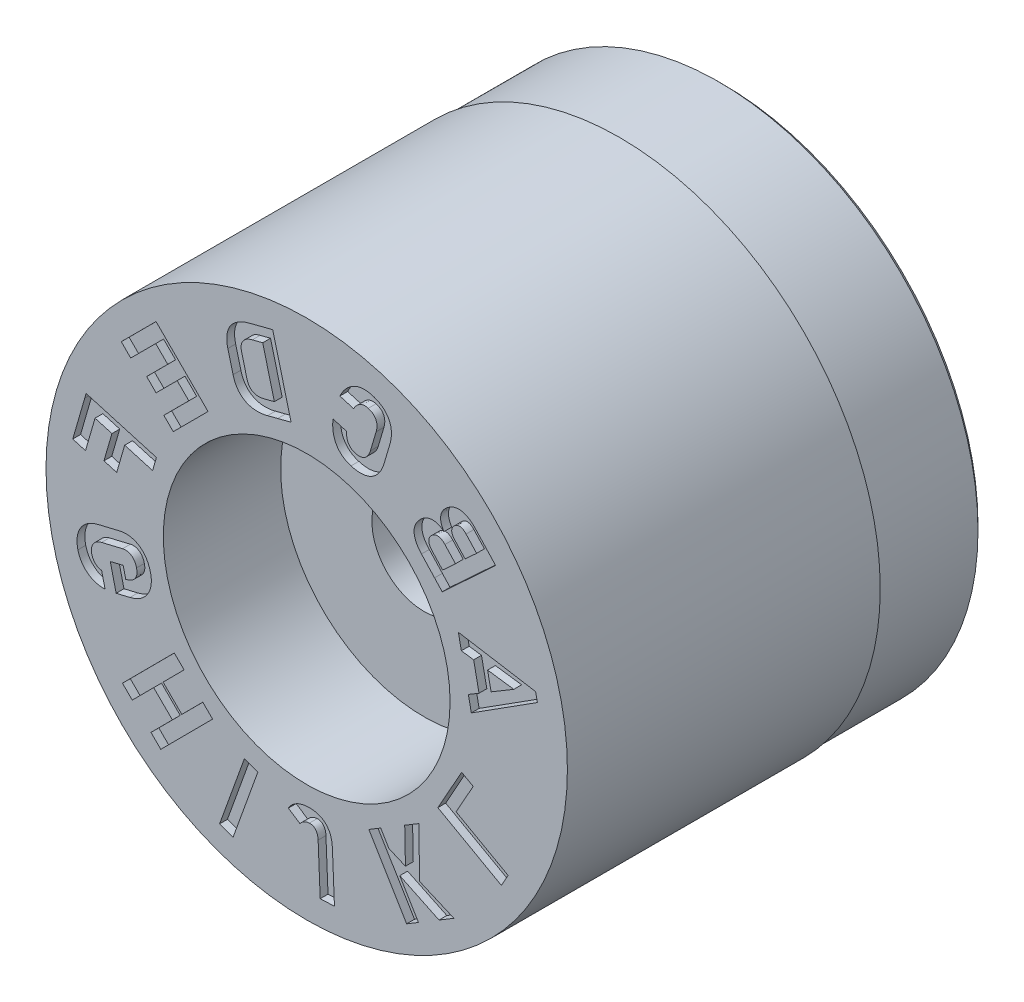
SolidWorks part; units mm, degrees
ref_plane "Front Plane" through (0, 0, 0) normal (0, 0, 1) x (1, 0, 0)
ref_plane "Top Plane" through (0, 0, 0) normal (0, 1, 0) x (1, 0, 0)
ref_plane "Right Plane" through (0, 0, 0) normal (1, 0, 0) x (0, 0, -1)
sketch "Sketch1" plane through (0, 0, 0) normal (1, 0, 0) x (0, 0, -1)
  line L2 (0, 10) -> (0, 5.5)
  line L3 (15.75, 10) -> (0, 10)
  line L4 (-3.7979, 0) -> (49996.2021, 0) construction
  line L8 (16, 2) -> (4.5, 2)
  line L9 (4.5, 5.5) -> (4.5, 2)
  line L10 (4.5, 5.5) -> (0, 5.5)
  line L12 (16, 2) -> (16, 9.75)
  line L16 (16, 9.75) -> (15.75, 10)
  dimension "D1" = 16
  dimension "D2" = 45
  dimension "D3" = 0.25
  dimension "D4" = 20
  dimension "D5" = 11
  dimension "D6" = 4.5
  dimension "D7" = 4
revolve "Revolve1" add sketch "Sketch1" angle 360 about L4
sketch "Sketch4" plane through (0, 0, 0) normal (1, 0, 0) x (0, 0, -1)
  line L0 (0, 0) -> (50000, 0) construction
  line L1 (16, -9.75) -> (16, 9.75) construction
  line L2 (12, 10.935) -> (16, 10.935)
  line L3 (12, 10.935) -> (12, 9.935)
  line L4 (12, 9.935) -> (16, 9.935)
  line L5 (16, 10.935) -> (16, 9.935)
  line L6 (15.75, 10) -> (0, 10) construction
  line L9 (0, 55) -> (0, -55) construction
  dimension "D1" = 1
  dimension "D2" = 0.065
  dimension "D3" = 12
revolve "Cut-Revolve1" cut sketch "Sketch4" angle 360 about L0
sketch "Sketch6" plane through (0, 0, 0) normal (0, 0, 1) x (1, 0, 0)
  line L0 (8.8489, 1.6501) -> (8.7816, 1.9788)
  line L1 (8.7816, 1.9788) -> (5.8181, 2.469)
  line L2 (5.8181, 2.469) -> (5.9323, 1.9115)
  line L3 (5.9323, 1.9115) -> (6.4045, 1.847)
  line L4 (7.9436, 1.6368) -> (7.073, 1.1165)
  line L5 (6.2007, 0.5953) -> (6.3149, 0.0378)
  line L6 (6.3149, 0.0378) -> (8.8489, 1.6501)
  line L7 (7.073, 1.1165) -> (6.9389, 1.774)
  line L8 (6.9389, 1.774) -> (7.9436, 1.6368)
  line L9 (6.4045, 1.847) -> (6.6098, 0.8397)
  line L10 (5.7062, 4.6892) -> (5.2131, 4.2327)
  line L11 (5.2131, 4.2327) -> (4.8084, 4.6701)
  line L12 (4.795, 5.173) -> (4.7993, 5.1767)
  line L13 (5.3014, 5.1267) -> (5.7062, 4.6892)
  line L14 (-8.4619, 3.2632) -> (-8.5153, 3.0775)
  line L15 (6.0783, 5.0337) -> (5.6735, 5.4712)
  line L16 (6.1129, 5.878) -> (6.5177, 5.4406)
  line L18 (7.247, 5.3993) -> (6.4734, 6.2349)
  line L19 (4.3815, 5.5116) -> (4.3778, 5.5079)
  line L20 (4.4024, 4.362) -> (4.9047, 3.8193)
  line L23 (6.5177, 5.4406) -> (6.0783, 5.0337)
  line L24 (5.1982, 3.5024) -> (4.9047, 3.8193)
  line L25 (5.1982, 3.5024) -> (7.247, 5.3993)
  line L26 (2.9706, 6.6541) -> (3.189, 7.3941)
  line L27 (1.2709, 8.0433) -> (1.7976, 7.8879)
  line L28 (2.6627, 7.5499) -> (2.4442, 6.81)
  line L29 (1.5346, 6.9981) -> (1.008, 7.1535)
  line L30 (-1.2404, 6.5996) -> (-1.6393, 6.4965)
  line L31 (-2.2899, 6.8256) -> (-2.4966, 7.6276)
  line L32 (-2.0871, 8.2308) -> (-1.6882, 8.3338)
  line L33 (-1.1127, 6.1054) -> (-1.1127, 6.1052)
  line L34 (-1.3029, 8.9606) -> (-2.2034, 8.728)
  line L35 (-3.024, 7.475) -> (-2.8252, 6.7039)
  line L36 (-1.4985, 6.0057) -> (-1.1127, 6.1054)
  line L37 (-4.9688, 5.4341) -> (-4.5213, 4.9875)
  line L38 (-5.7912, 6.2551) -> (-5.3306, 5.7953)
  line L39 (-1.6882, 8.3338) -> (-1.2404, 6.5996)
  line L40 (-1.1127, 6.1052) -> (-0.5998, 6.238)
  line L41 (-0.5998, 6.238) -> (-1.3029, 8.9606)
  line L42 (-6.9814, 2.2839) -> (-5.9112, 1.9745)
  line L43 (-6.154, 6.6172) -> (-6.1539, 6.617)
  line L44 (-8.119, 2.6129) -> (-7.4711, 2.4255)
  line L45 (-3.7843, 5.0015) -> (-5.779, 6.9925)
  line L46 (-4.5213, 4.9875) -> (-5.4803, 4.0267)
  line L47 (-5.4803, 4.0267) -> (-5.1181, 3.6654)
  line L48 (-5.1181, 3.6654) -> (-3.7843, 5.0015)
  line L49 (-5.1519, -5.9268) -> (-5.9732, -6.7525)
  line L50 (-5.3306, 5.7953) -> (-6.1386, 4.9858)
  line L51 (-6.1386, 4.9858) -> (-5.777, 4.6245)
  line L52 (-5.777, 4.6245) -> (-4.9688, 5.4341)
  line L53 (-5.5084, -4.8502) -> (-4.7033, -4.0409)
  line L54 (-5.779, 6.9925) -> (-7.1128, 5.6564)
  line L55 (-7.1128, 5.6564) -> (-6.75, 5.2945)
  line L56 (-6.75, 5.2945) -> (-5.7912, 6.2551)
  line L57 (3.7877, -6.3185) -> (3.1532, -6.0457)
  line L58 (3.1532, -6.0457) -> (2.8394, -5.5238)
  line L59 (-8.6089, 2.7545) -> (-8.6087, 2.7545)
  line L60 (-5.9112, 1.9745) -> (-5.7642, 2.4832)
  line L61 (-5.7642, 2.4832) -> (-8.4619, 3.2632)
  line L62 (-7.4711, 2.4255) -> (-7.7774, 1.3667)
  line L63 (-7.7774, 1.3667) -> (-7.2877, 1.2249)
  line L64 (-7.2877, 1.2249) -> (-6.9814, 2.2839)
  line L65 (6.6098, 0.8397) -> (6.2007, 0.5953)
  line L66 (-8.5153, 3.0775) -> (-8.9742, 1.4913)
  line L67 (-8.9742, 1.4913) -> (-8.4845, 1.3495)
  line L68 (-8.4845, 1.3495) -> (-8.119, 2.6129)
  line L70 (-7.3095, -2.7992) -> (-6.7777, -2.6725)
  line L71 (-7.1921, -0.6661) -> (-7.9949, -0.8574)
  line L72 (-7.7341, -2.8762) -> (-7.8662, -2.3222)
  line L73 (-7.8685, -1.3887) -> (-7.0656, -1.1974)
  line L74 (-6.897, -2.1389) -> (-6.9413, -2.1498)
  line L75 (-6.9413, -2.1498) -> (-7.0395, -1.7378)
  line L76 (-7.0395, -1.7378) -> (-7.5343, -1.8554)
  line L77 (-7.5343, -1.8554) -> (-7.3095, -2.7992)
  line L78 (-5.9732, -6.7525) -> (-5.5966, -7.1274)
  line L79 (-5.5966, -7.1274) -> (-3.6091, -5.1292)
  line L80 (-3.6091, -5.1292) -> (-3.9857, -4.7543)
  line L81 (-3.9857, -4.7543) -> (-4.7908, -5.5638)
  line L82 (-7.0669, -5.6648) -> (-6.6909, -6.0391)
  line L83 (-6.6909, -6.0391) -> (-5.8694, -5.2133)
  line L84 (-4.7033, -4.0409) -> (-5.0794, -3.6666)
  line L85 (-5.0794, -3.6666) -> (-7.0669, -5.6648)
  line L86 (-5.8694, -5.2133) -> (-5.1519, -5.9268)
  line L88 (-4.7908, -5.5638) -> (-5.5084, -4.8502)
  line L90 (-1.8737, -6.02) -> (-2.3902, -5.834)
  line L91 (-2.3902, -5.834) -> (-3.3413, -8.4772)
  line L92 (-3.3413, -8.4772) -> (-2.8247, -8.6632)
  line L93 (-2.8247, -8.6632) -> (-1.8737, -6.02)
  line L94 (-0.7031, -6.6325) -> (-0.2586, -6.9285)
  line L95 (0.4381, -7.1238) -> (0.5178, -9.0319)
  line L96 (0.5178, -9.0319) -> (1.0645, -9.009)
  line L97 (1.0645, -9.009) -> (0.9851, -7.0986)
  line L98 (3.5704, -6.7396) -> (5.0752, -7.4623)
  line L99 (5.0752, -7.4623) -> (5.6476, -7.1182)
  line L100 (5.6476, -7.1182) -> (4.3327, -6.5529)
  line L102 (3.8346, -8.2079) -> (4.2891, -7.935)
  line L103 (4.2891, -7.935) -> (3.5704, -6.7396)
  line L104 (2.8394, -5.5238) -> (2.385, -5.7967)
  line L105 (2.385, -5.7967) -> (3.8346, -8.2079)
  line L107 (4.3327, -6.5529) -> (4.2987, -4.6462)
  line L108 (4.2987, -4.6462) -> (3.7595, -4.9704)
  line L109 (3.7595, -4.9704) -> (3.7877, -6.3185)
  line L110 (7.4671, -5.1142) -> (7.7241, -4.6549)
  line L111 (7.7241, -4.6549) -> (5.7302, -3.5394)
  line L113 (5.0304, -3.7509) -> (7.4671, -5.1142)
  line L114 (5.7302, -3.5394) -> (6.3866, -2.3666)
  line L115 (6.3866, -2.3666) -> (5.9438, -2.1189)
  line L116 (5.9438, -2.1189) -> (5.0304, -3.7509)
  spline S0 degree 3 poles (4.8084, 4.6701) (4.7719, 4.7095) (4.7244, 4.7723) (4.6894, 4.8662) (4.6796, 4.9331) (4.6858, 4.9988) (4.7154, 5.0854) (4.7597, 5.1411) (4.795, 5.173) knots 0 0 0 0 0.283315 0.406294 0.522921 0.635859 0.749287 1 1 1 1
  spline S1 degree 3 poles (4.7993, 5.1767) (4.8235, 5.199) (4.862, 5.2285) (4.919, 5.2553) (4.9614, 5.2683) (5.0045, 5.2742) (5.0479, 5.2732) (5.0913, 5.2652) (5.1345, 5.25) (5.1776, 5.2288) (5.2366, 5.191) (5.2758, 5.1534) (5.3014, 5.1267) knots 0 0 0 0 0.172627 0.251574 0.328523 0.403935 0.478746 0.554865 0.634107 0.717711 0.805952 1 1 1 1
  spline S2 degree 3 poles (5.6735, 5.4712) (5.6404, 5.5069) (5.5975, 5.5641) (5.5676, 5.6502) (5.5597, 5.7117) (5.5666, 5.7725) (5.5972, 5.8527) (5.6384, 5.9049) (5.672, 5.9348) knots 0 0 0 0 0.278818 0.399136 0.515115 0.628924 0.74378 1 1 1 1
  spline S3 degree 3 poles (5.672, 5.9348) (5.7016, 5.9631) (5.7529, 5.9958) (5.8296, 6.0152) (5.8873, 6.0135) (5.9456, 5.9996) (6.0272, 5.9613) (6.0791, 5.9125) (6.1129, 5.878) knots 0 0 0 0 0.243701 0.354495 0.466946 0.584007 0.70994 1 1 1 1
  spline S4 degree 3 poles (6.4734, 6.2349) (6.4164, 6.2965) (6.3264, 6.3802) (6.1936, 6.4672) (6.0957, 6.515) (5.9975, 6.5485) (5.8991, 6.5661) (5.8009, 6.568) (5.7036, 6.5537) (5.6075, 6.5254) (5.4792, 6.4644) (5.392, 6.3983) (5.3375, 6.348) knots 0 0 0 0 0.194513 0.282787 0.366597 0.44605 0.522154 0.597137 0.672453 0.74883 0.828294 1 1 1 1
  spline S5 degree 3 poles (5.3375, 6.348) (5.3003, 6.3124) (5.248, 6.2563) (5.1969, 6.1703) (5.1674, 6.1051) (5.1479, 6.0374) (5.1373, 5.9682) (5.1361, 5.8973) (5.1437, 5.8252) (5.161, 5.7524) (5.1954, 5.6524) (5.2353, 5.5814) (5.2653, 5.5352) knots 0 0 0 0 0.172669 0.253654 0.333238 0.411123 0.488218 0.566498 0.647256 0.72985 0.815786 1 1 1 1
  spline S6 degree 3 poles (5.2653, 5.5352) (5.2206, 5.5734) (5.1485, 5.6209) (5.0459, 5.6681) (4.9694, 5.6916) (4.8926, 5.7053) (4.816, 5.708) (4.7399, 5.7017) (4.6648, 5.6833) (4.5909, 5.6558) (4.4921, 5.6036) (4.4242, 5.5513) (4.3815, 5.5116) knots 0 0 0 0 0.179772 0.263567 0.345522 0.424654 0.50231 0.579814 0.658235 0.738636 0.821202 1 1 1 1
  spline S7 degree 3 poles (4.3778, 5.5079) (4.3226, 5.4574) (4.2498, 5.3747) (4.1785, 5.2505) (4.1426, 5.1563) (4.1207, 5.06) (4.116, 4.9615) (4.1256, 4.8616) (4.1511, 4.7604) (4.1918, 4.6591) (4.2692, 4.5204) (4.3447, 4.4233) (4.4024, 4.362) knots 0 0 0 0 0.172446 0.251873 0.328717 0.403984 0.478532 0.555075 0.634512 0.718035 0.806069 1 1 1 1
  spline S8 degree 3 poles (1.6985, 5.9372) (1.7479, 5.9221) (1.8222, 5.9049) (1.9208, 5.8888) (1.9918, 5.8817) (2.0612, 5.8791) (2.129, 5.8815) (2.1952, 5.8876) (2.2595, 5.8985) (2.3218, 5.9141) (2.3823, 5.9335) (2.4402, 5.958) (2.4955, 5.9872) (2.5494, 6.0191) (2.6006, 6.0563) (2.649, 6.0983) (2.6958, 6.1438) (2.7394, 6.194) (2.781, 6.2477) (2.8197, 6.3056) (2.8555, 6.3675) (2.8886, 6.4334) (2.9292, 6.5286) (2.9556, 6.6028) (2.9706, 6.6541) knots 0 0 0 0 0.093297 0.137613 0.180497 0.222109 0.263103 0.302983 0.342145 0.380803 0.418913 0.456756 0.494311 0.531814 0.569788 0.6085 0.647604 0.687556 0.728598 0.770188 0.813197 0.857791 0.903443 1 1 1 1
  spline S9 degree 3 poles (3.189, 7.3941) (3.2035, 7.4456) (3.2234, 7.522) (3.2402, 7.624) (3.2482, 7.6972) (3.2512, 7.7687) (3.2511, 7.8383) (3.2456, 7.9059) (3.2355, 7.9715) (3.2216, 8.0352) (3.2029, 8.0966) (3.1803, 8.1559) (3.1532, 8.2126) (3.1222, 8.267) (3.0864, 8.3187) (3.0464, 8.368) (3.0028, 8.4155) (2.9549, 8.4599) (2.9031, 8.5016) (2.8472, 8.5402) (2.7875, 8.576) (2.7241, 8.6088) (2.6327, 8.6491) (2.5607, 8.6742) (2.511, 8.6886) knots 0 0 0 0 0.096696 0.142384 0.186623 0.229569 0.271486 0.312156 0.352062 0.391166 0.429912 0.467766 0.505705 0.543188 0.58076 0.619102 0.657757 0.697173 0.736887 0.777785 0.819711 0.862502 0.906661 1 1 1 1
  spline S10 degree 3 poles (2.511, 8.6886) (2.4303, 8.7123) (2.3069, 8.7352) (2.1426, 8.7333) (2.0244, 8.7156) (1.91, 8.6833) (1.8002, 8.6355) (1.696, 8.5719) (1.5968, 8.4942) (1.5041, 8.4017) (1.3861, 8.2564) (1.3142, 8.1313) (1.2709, 8.0433) knots 0 0 0 0 0.164412 0.242918 0.32004 0.397163 0.474329 0.553242 0.635005 0.719818 0.808383 1 1 1 1
  spline S11 degree 3 poles (1.7976, 7.8879) (1.8192, 7.9273) (1.8548, 7.9829) (1.9115, 8.0473) (1.955, 8.0887) (2.0008, 8.1237) (2.0479, 8.1532) (2.0977, 8.1742) (2.1484, 8.19) (2.2006, 8.1986) (2.2724, 8.2016) (2.3261, 8.1908) (2.361, 8.1809) knots 0 0 0 0 0.19507 0.285229 0.371953 0.455276 0.535053 0.612466 0.689229 0.76522 0.841734 1 1 1 1
  spline S12 degree 3 poles (2.361, 8.1809) (2.4053, 8.1676) (2.4686, 8.1427) (2.542, 8.0938) (2.5876, 8.0521) (2.6255, 8.0051) (2.6558, 7.9531) (2.6773, 7.8958) (2.6914, 7.834) (2.6971, 7.7679) (2.6928, 7.6717) (2.6768, 7.5988) (2.6627, 7.5499) knots 0 0 0 0 0.17467 0.254393 0.331603 0.407223 0.481412 0.557968 0.637188 0.720074 0.807639 1 1 1 1
  spline S13 degree 3 poles (2.4442, 6.81) (2.4293, 6.7613) (2.4034, 6.6913) (2.3539, 6.6087) (2.3136, 6.5565) (2.2689, 6.5118) (2.2191, 6.477) (2.1664, 6.4487) (2.1089, 6.4304) (2.048, 6.4208) (1.9598, 6.4191) (1.8931, 6.4327) (1.8487, 6.4454) knots 0 0 0 0 0.193101 0.280209 0.363265 0.442166 0.518057 0.592487 0.667665 0.745105 0.824929 1 1 1 1
  spline S14 degree 3 poles (1.8487, 6.4454) (1.8135, 6.4567) (1.7619, 6.4769) (1.702, 6.5178) (1.6623, 6.5529) (1.6275, 6.5933) (1.5976, 6.6383) (1.5733, 6.6882) (1.5537, 6.7422) (1.5401, 6.8009) (1.5292, 6.8866) (1.5305, 6.953) (1.5346, 6.9981) knots 0 0 0 0 0.160269 0.236684 0.312318 0.388486 0.466474 0.544946 0.627589 0.714157 0.804509 1 1 1 1
  spline S15 degree 3 poles (1.008, 7.1535) (0.9965, 7.0559) (0.9911, 6.9116) (1.0106, 6.7249) (1.039, 6.5969) (1.0792, 6.4777) (1.1319, 6.3679) (1.1982, 6.2684) (1.2757, 6.1786) (1.3651, 6.0995) (1.502, 6.0089) (1.6176, 5.9606) (1.6985, 5.9372) knots 0 0 0 0 0.191851 0.280864 0.365986 0.447455 0.526149 0.603183 0.680196 0.757228 0.835631 1 1 1 1
  spline S16 degree 3 poles (-1.6393, 6.4965) (-1.6791, 6.4857) (-1.7384, 6.4747) (-1.8163, 6.4684) (-1.8707, 6.468) (-1.9224, 6.4736) (-1.972, 6.4826) (-2.0185, 6.4976) (-2.0627, 6.5161) (-2.1031, 6.5404) (-2.1412, 6.5677) (-2.1747, 6.6007) (-2.2056, 6.637) (-2.2321, 6.6782) (-2.2633, 6.7401) (-2.2814, 6.7902) (-2.2899, 6.8256) knots 0 0 0 0 0.149537 0.217662 0.283028 0.345893 0.406043 0.464998 0.522452 0.579275 0.635372 0.691587 0.749136 0.807832 0.868485 1 1 1 1
  spline S17 degree 3 poles (-2.4966, 7.6276) (-2.5057, 7.6626) (-2.5158, 7.7151) (-2.5177, 7.7846) (-2.5139, 7.8335) (-2.5051, 7.8804) (-2.4915, 7.9253) (-2.4725, 7.9683) (-2.4475, 8.0085) (-2.4187, 8.0469) (-2.3847, 8.082) (-2.3463, 8.1142) (-2.3036, 8.144) (-2.2558, 8.17) (-2.1845, 8.2023) (-2.1271, 8.221) (-2.0871, 8.2308) knots 0 0 0 0 0.131189 0.192464 0.251083 0.30829 0.364767 0.420807 0.477848 0.535796 0.594155 0.654507 0.716776 0.782178 0.851242 1 1 1 1
  spline S18 degree 3 poles (-2.2034, 8.728) (-2.2582, 8.714) (-2.3381, 8.69) (-2.44, 8.6504) (-2.5112, 8.619) (-2.5784, 8.5845) (-2.6413, 8.5468) (-2.7007, 8.5072) (-2.7554, 8.4641) (-2.8064, 8.4194) (-2.8524, 8.3713) (-2.8948, 8.3216) (-2.9316, 8.2686) (-2.9647, 8.2141) (-2.9929, 8.1569) (-3.0166, 8.0974) (-3.036, 8.0356) (-3.0511, 7.9719) (-3.0607, 7.9061) (-3.067, 7.8386) (-3.0672, 7.7692) (-3.0638, 7.698) (-3.0527, 7.5991) (-3.0364, 7.525) (-3.024, 7.475) knots 0 0 0 0 0.099691 0.146684 0.192416 0.236651 0.279548 0.32158 0.362276 0.402096 0.440982 0.479364 0.516967 0.554484 0.591558 0.629172 0.667081 0.705498 0.744424 0.784001 0.8248 0.866596 0.909394 1 1 1 1
  spline S19 degree 3 poles (-2.8252, 6.7039) (-2.8123, 6.6566) (-2.7913, 6.5868) (-2.7545, 6.4986) (-2.7248, 6.4363) (-2.6916, 6.3775) (-2.6551, 6.3221) (-2.6152, 6.2704) (-2.5727, 6.2215) (-2.5268, 6.1764) (-2.478, 6.1354) (-2.426, 6.0986) (-2.3711, 6.0656) (-2.3133, 6.0362) (-2.2522, 6.0118) (-2.1884, 5.991) (-2.1216, 5.9737) (-2.0521, 5.9616) (-1.98, 5.9534) (-1.9056, 5.9508) (-1.8287, 5.9518) (-1.7495, 5.958) (-1.6386, 5.9736) (-1.5547, 5.9905) (-1.4985, 6.0057) knots 0 0 0 0 0.086583 0.128101 0.168414 0.208325 0.247012 0.285336 0.323423 0.3612 0.39857 0.435772 0.473335 0.511474 0.549867 0.589259 0.629829 0.671313 0.713653 0.757596 0.802458 0.849282 0.897488 1 1 1 1
  spline S20 degree 3 poles (-6.7777, -2.6725) (-6.7285, -2.6611) (-6.6568, -2.6397) (-6.5645, -2.6047) (-6.4996, -2.5751) (-6.4379, -2.5421) (-6.3796, -2.5054) (-6.324, -2.4661) (-6.2721, -2.4231) (-6.2235, -2.3776) (-6.1788, -2.3295) (-6.1383, -2.2787) (-6.1015, -2.2258) (-6.0696, -2.1702) (-6.0404, -2.1129) (-6.0167, -2.0525) (-5.9965, -1.9901) (-5.9804, -1.9257) (-5.969, -1.8598) (-5.9619, -1.7927) (-5.9591, -1.7245) (-5.9607, -1.655) (-5.9707, -1.5594) (-5.9829, -1.4875) (-5.9947, -1.4396) knots 0 0 0 0 0.092043 0.136304 0.179677 0.221988 0.263767 0.305152 0.346029 0.386511 0.426441 0.465694 0.504791 0.543643 0.582543 0.621845 0.661806 0.70212 0.742754 0.783626 0.824911 0.867095 0.910234 1 1 1 1
  spline S21 degree 3 poles (-5.9947, -1.4396) (-6.0063, -1.3914) (-6.027, -1.3209) (-6.0612, -1.2303) (-6.0902, -1.1663) (-6.1229, -1.1058) (-6.1584, -1.0481) (-6.1967, -0.9933) (-6.2387, -0.9422) (-6.2831, -0.8946) (-6.3296, -0.8505) (-6.3787, -0.8105) (-6.4302, -0.7744) (-6.4842, -0.7423) (-6.5403, -0.714) (-6.5985, -0.6896) (-6.6592, -0.6699) (-6.7214, -0.654) (-6.785, -0.6427) (-6.8497, -0.6346) (-6.9159, -0.6326) (-6.9833, -0.6337) (-7.0761, -0.643) (-7.1457, -0.6547) (-7.1921, -0.6661) knots 0 0 0 0 0.092528 0.137191 0.18094 0.2236 0.265686 0.307351 0.34848 0.389193 0.428877 0.468173 0.507286 0.546427 0.585308 0.624626 0.66433 0.704382 0.74447 0.784981 0.826023 0.868148 0.910912 1 1 1 1
  spline S22 degree 3 poles (-7.9949, -0.8574) (-8.0441, -0.8689) (-8.1158, -0.8903) (-8.208, -0.9253) (-8.273, -0.9548) (-8.3345, -0.988) (-8.3932, -1.0237) (-8.4484, -1.0632) (-8.5001, -1.1059) (-8.5483, -1.1513) (-8.5925, -1.1994) (-8.6334, -1.2497) (-8.6685, -1.3035) (-8.7023, -1.358) (-8.7297, -1.4164) (-8.7546, -1.4764) (-8.7744, -1.5391) (-8.7909, -1.6033) (-8.8014, -1.6693) (-8.8087, -1.7362) (-8.8114, -1.8044) (-8.8098, -1.8739) (-8.7998, -1.9695) (-8.7876, -2.0414) (-8.7759, -2.0893) knots 0 0 0 0 0.092142 0.136451 0.179871 0.222227 0.264021 0.305107 0.346028 0.38622 0.425868 0.465163 0.504167 0.543165 0.58204 0.621645 0.661649 0.702006 0.742477 0.783393 0.824723 0.866953 0.910137 1 1 1 1
  spline S23 degree 3 poles (-8.7759, -2.0893) (-8.7575, -2.1681) (-8.7171, -2.2819) (-8.6402, -2.4218) (-8.5709, -2.5165) (-8.492, -2.6022) (-8.4041, -2.6772) (-8.3078, -2.741) (-8.2039, -2.7933) (-8.0934, -2.834) (-7.9371, -2.8712) (-7.8157, -2.8796) (-7.7341, -2.8762) knots 0 0 0 0 0.170782 0.253604 0.33623 0.418124 0.499154 0.579581 0.66146 0.74446 0.827691 1 1 1 1
  spline S24 degree 3 poles (-7.8662, -2.3222) (-7.8963, -2.3193) (-7.9414, -2.3114) (-7.9974, -2.2879) (-8.0375, -2.266) (-8.0746, -2.239) (-8.1092, -2.2086) (-8.1408, -2.1742) (-8.1967, -2.0979) (-8.2297, -2.0245) (-8.2441, -1.9626) knots 0 0 0 0 0.162958 0.244284 0.326105 0.408113 0.490852 0.573864 0.659071 1 1 1 1
  spline S25 degree 3 poles (-8.2441, -1.9626) (-8.2546, -1.9196) (-8.2625, -1.8543) (-8.256, -1.7686) (-8.2431, -1.7081) (-8.2218, -1.651) (-8.1921, -1.598) (-8.1553, -1.549) (-8.1102, -1.5054) (-8.0589, -1.4664) (-7.9794, -1.4228) (-7.9143, -1.399) (-7.8685, -1.3887) knots 0 0 0 0 0.171945 0.253181 0.333045 0.411488 0.489168 0.568155 0.648784 0.732131 0.817931 1 1 1 1
  spline S26 degree 3 poles (-7.0656, -1.1974) (-7.0253, -1.187) (-6.964, -1.1809) (-6.8834, -1.1869) (-6.8265, -1.2007) (-6.7727, -1.2223) (-6.7225, -1.251) (-6.6771, -1.2877) (-6.6358, -1.3311) (-6.5999, -1.3814) (-6.5576, -1.458) (-6.5372, -1.5221) (-6.5265, -1.5663) knots 0 0 0 0 0.169159 0.249202 0.328416 0.406962 0.484802 0.563207 0.644146 0.72814 0.81425 1 1 1 1
  spline S27 degree 3 poles (-6.5265, -1.5663) (-6.516, -1.6099) (-6.5068, -1.6757) (-6.5121, -1.7621) (-6.5247, -1.8224) (-6.5451, -1.8792) (-6.5729, -1.9319) (-6.6092, -1.9801) (-6.6532, -2.0232) (-6.7045, -2.0613) (-6.7841, -2.1055) (-6.8505, -2.1282) (-6.897, -2.1389) knots 0 0 0 0 0.174617 0.256198 0.335687 0.413135 0.490105 0.566861 0.646875 0.728727 0.814623 1 1 1 1
  spline S28 degree 3 poles (0.0528, -6.217) (-0.0288, -6.2208) (-0.1492, -6.2364) (-0.2997, -6.2859) (-0.4024, -6.3339) (-0.4956, -6.3928) (-0.6039, -6.4861) (-0.6696, -6.5704) (-0.7031, -6.6325) knots 0 0 0 0 0.272276 0.400403 0.525909 0.648158 0.765975 1 1 1 1
  spline S29 degree 3 poles (-0.2586, -6.9285) (-0.2374, -6.8988) (-0.2012, -6.8577) (-0.1444, -6.8127) (-0.0988, -6.7842) (-0.0505, -6.7615) (0.0159, -6.7378) (0.0683, -6.7301) (0.1031, -6.7281) knots 0 0 0 0 0.256043 0.381066 0.50692 0.632263 0.754859 1 1 1 1
  spline S30 degree 3 poles (0.1031, -6.7281) (0.1489, -6.726) (0.2181, -6.7347) (0.2969, -6.7789) (0.3454, -6.8253) (0.384, -6.884) (0.4256, -6.9822) (0.4352, -7.0661) (0.4381, -7.1238) knots 0 0 0 0 0.235778 0.345103 0.457449 0.575518 0.702627 1 1 1 1
  spline S31 degree 3 poles (0.9851, -7.0986) (0.9824, -7.0519) (0.9777, -6.9829) (0.9623, -6.8937) (0.9477, -6.8308) (0.9309, -6.7704) (0.9107, -6.7127) (0.8865, -6.6582) (0.8513, -6.5897) (0.7996, -6.5108) (0.7245, -6.4284) (0.6386, -6.3579) (0.5576, -6.3117) (0.4881, -6.2812) (0.4333, -6.2608) (0.3756, -6.2455) (0.3157, -6.2325) (0.2534, -6.2227) (0.1654, -6.2159) (0.0983, -6.2147) (0.0528, -6.217) knots 0 0 0 0 0.096261 0.141811 0.186072 0.229115 0.270773 0.311724 0.351538 0.429095 0.504996 0.579977 0.656705 0.695921 0.736005 0.77685 0.818556 0.862015 0.906458 1 1 1 1
extrude "Cut-Extrude1" cut sketch "Sketch6" against normal blind 0.3 contours L9 L65 L5 L6 L0 L1 L2 L3 L7 L8 L4 | L19 S7 L20 L24 L25 L18 S4 S5 S6 S2 S3 L16 L23 L15 L12 S1 L13 L10 L11 S0 | L29 S15 S8 L26 S9 S10 L27 S11 S12 L28 S13 S14 | L35 S19 L36 L33 L40 L41 L34 S18 L31 S17 L32 L39 L30 S16 | L55 L56 L38 L50 L51 L52 L37 L46 L47 L48 L45 L54 | L115 L116 L113 L110 L111 L114 | L108 L109 L57 L58 L104 L105 L102 L103 L98 L99 L100 L107 | L97 S31 S28 L94 S29 S30 L95 L96 | L92 L93 L90 L91 | L81 L88 L53 L84 L85 L82 L83 L86 L49 L78 L79 L80 | S26 S27 L74 L75 L76 L77 L70 S20 S21 L71 S22 S23 L72 S24 S25 L73 | L67 L68 L44 L62 L63 L64 L42 L60 L61 L14 L66
